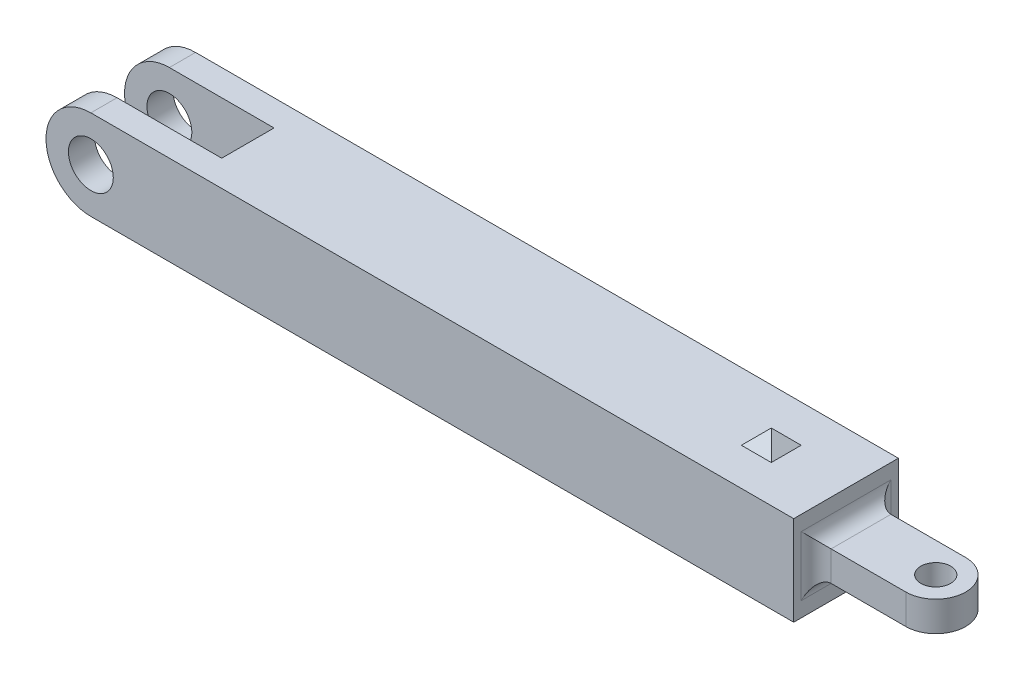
SolidWorks part; units mm, degrees
ref_plane "Front Plane" through (0, 0, 0) normal (0, 0, 1) x (1, 0, 0)
ref_plane "Top Plane" through (0, 0, 0) normal (0, 1, 0) x (1, 0, 0)
ref_plane "Right Plane" through (0, 0, 0) normal (1, 0, 0) x (0, 0, -1)
sketch "Sketch1" plane through (0, 0, 0) normal (0, 0, 1) x (1, 0, 0)
  line L0 (0, -6) -> (0, 6)
  line L1 (0, -6) -> (-94, -6)
  line L2 (0, 6) -> (-94, 6)
  line L3 (0, 0) -> (-159.7597, 0) construction
  arc A0 (-94, 6) -> (-94, -6) centre (-94, 0) ccw
  circle A1 centre (-94, 0) radius 3
  dimension "D2" = 6
  dimension "D3" = 6
  dimension "D1" = 94
extrude "Boss-Extrude1" add sketch "Sketch1" along normal mid plane 14
sketch "Sketch2" plane through (0, 6, 0) normal (0, 1, 0) x (1, 0, 0)
  line L0 (-80, 3.5) -> (-80, -3.5)
  line L1 (-80, -3.5) -> (-100, -3.5)
  line L2 (-100, 7) -> (-100, -7) construction
  line L3 (-100, -3.5) -> (-100, 3.5)
  line L4 (-100, 3.5) -> (-80, 3.5)
  line L5 (0, 0) -> (-80, 0) construction
  line L6 (-100, -7) -> (-94, -7) construction
  dimension "D1" = 3.5
  dimension "D2" = 20
extrude "Cut-Extrude1" cut sketch "Sketch2" against normal through all
sketch "Sketch3" plane through (0, 0, 0) normal (1, 0, 0) x (0, 0, -1)
  line L0 (-7, 6) -> (7, 6) construction
  line L1 (-4, -2) -> (4, -2)
  line L2 (-4, -2) -> (-4, 2)
  line L3 (-4, 2) -> (4, 2)
  line L4 (4, -2) -> (4, 2)
  line L5 (-4, -2) -> (4, 2) construction
  line L6 (-4, 2) -> (4, -2) construction
  line L7 (-7, -6) -> (-7, 6) construction
  point P0 (0, 0)
  dimension "D1" = 4
  dimension "D2" = 3
extrude "Boss-Extrude2" add sketch "Sketch3" along normal blind 16
sketch "Sketch4" plane through (0, -2, 0) normal (0, -1, 0) x (1, 0, 0)
  line L0 (0, 0) -> (34.1841, 0) construction
  line L1 (0, 4) -> (0, -4) construction
  line L2 (16, 4) -> (16, -4) construction
  line L3 (16, 4) -> (0, 4) construction
  line L4 (16, -4) -> (0, -4) construction
  line L5 (12, 4) -> (16, 4)
  line L6 (16, 4) -> (16, -4)
  line L7 (16, -4) -> (12, -4)
  circle A0 centre (12, 0) radius 2
  arc A1 (12, 4) -> (12, -4) centre (12, 0) cw
  dimension "D2" = 4
  dimension "D1" = 4
extrude "Cut-Extrude2" cut sketch "Sketch4" against normal through all contours A0 L0 | L0 A0 | A1 M3 M2 | A1 L6 M4
fillet "Fillet1" radius 2 4 edges at (0, 0, 4) (0, 2, 0) (0, 0, -4) (0, -2, 0)
sketch "Sketch5" plane through (0, -6, 0) normal (0, -1, 0) x (1, 0, 0)
  line L0 (0, 7) -> (0, -7) construction
  line L1 (-12, -2) -> (-8, -2)
  line L2 (-12, -2) -> (-12, 2)
  line L3 (-12, 2) -> (-8, 2)
  line L4 (-8, -2) -> (-8, 2)
  line L5 (-12, -2) -> (-8, 2) construction
  line L6 (-12, 2) -> (-8, -2) construction
  point P0 (-10, 0)
  point P5 (0, 0)
  dimension "D1" = 10
  dimension "D2" = 4
extrude "Boss-Extrude3" add sketch "Sketch5" along normal blind 4 draft 45
mirror "Mirror1" about plane through (0, 0, 0) normal (0, 1, 0) of "Boss-Extrude3"
